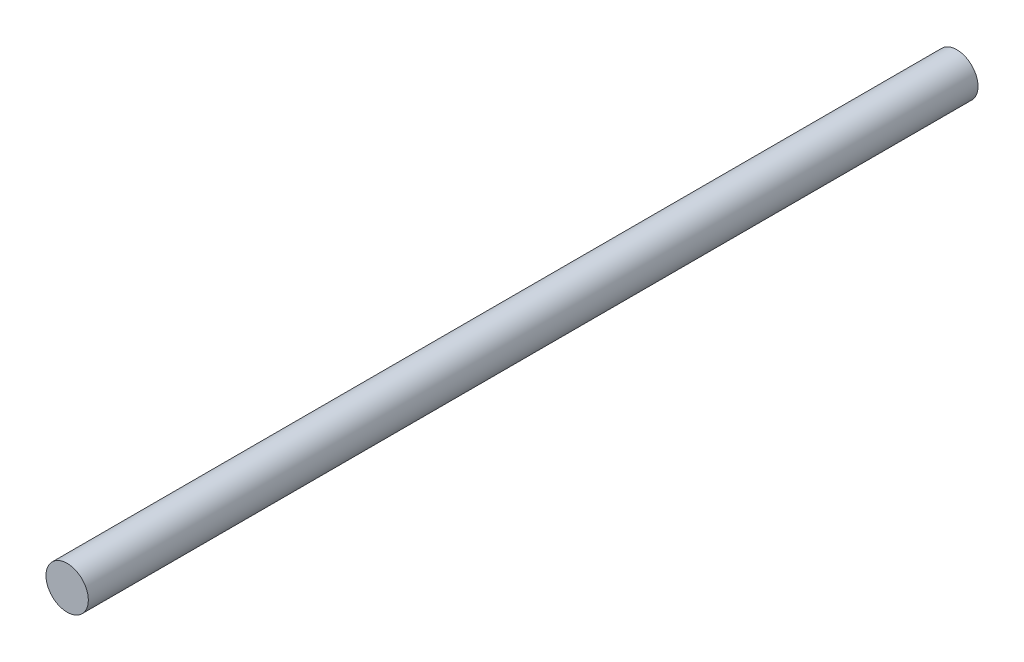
SolidWorks part; units mm, degrees
ref_plane "Front Plane" through (0, 0, 0) normal (0, 0, 1) x (1, 0, 0)
ref_plane "Top Plane" through (0, 0, 0) normal (0, 1, 0) x (1, 0, 0)
ref_plane "Right Plane" through (0, 0, 0) normal (1, 0, 0) x (0, 0, -1)
sketch "Sketch1" plane through (0, 0, 0) normal (0, 0, 1) x (1, 0, 0)
  circle A0 centre (0, 0) radius 6.35
  dimension "D1" = 12.7
extrude "Boss-Extrude1" add sketch "Sketch1" along normal blind 266.7
